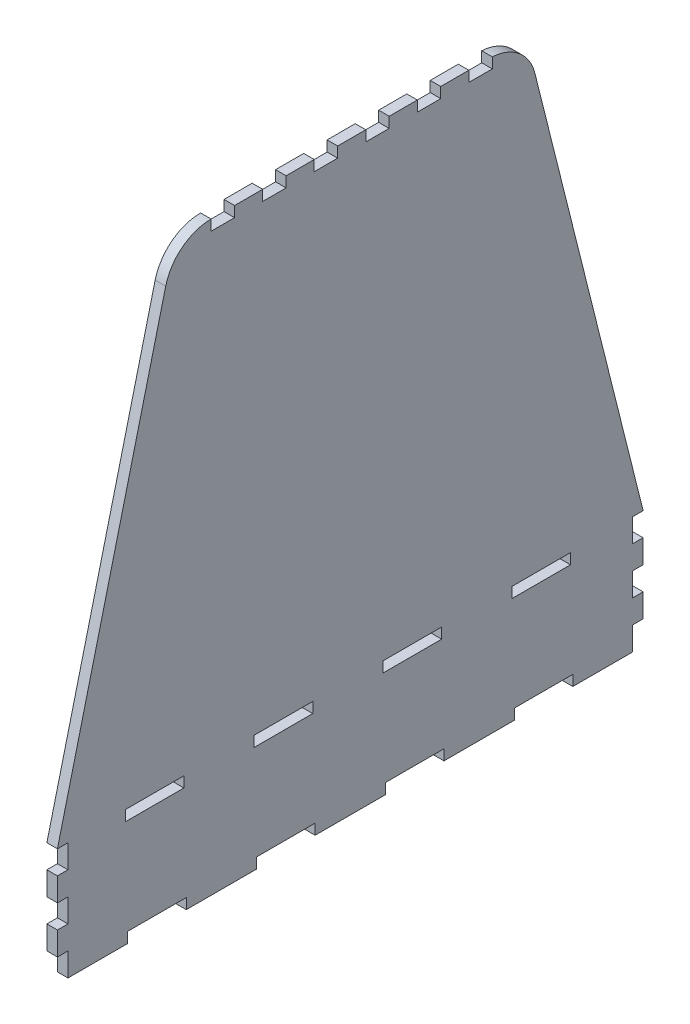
SolidWorks part; units mm, degrees
ref_plane "Front Plane" through (0, 0, 0) normal (0, 0, 1) x (1, 0, 0)
ref_plane "Top Plane" through (0, 0, 0) normal (0, 1, 0) x (1, 0, 0)
ref_plane "Right Plane" through (0, 0, 0) normal (1, 0, 0) x (0, 0, -1)
sketch "Sketch2" plane through (0, 0, 0) normal (1, 0, 0) x (0, 0, -1)
  line L1 (250, -256.4378) -> (157.5746, 113.2637)
  line L2 (118.7689, 143.5622) -> (-118.7689, 143.5622)
  line L3 (-157.5746, 113.2637) -> (-250, -256.4378)
  line L83 (250, -256.4378) -> (250, -356.4378)
  line L84 (250, -356.4378) -> (-250, -356.4378)
  line L85 (-250, -256.4378) -> (-250, -356.4378)
  arc A2 (-118.7689, 143.5622) -> (-157.5746, 113.2637) centre (-118.7689, 103.5622) ccw
  arc A3 (157.5746, 113.2637) -> (118.7689, 143.5622) centre (118.7689, 103.5622) ccw
  point P2 (0, 143.5622)
  point P5 (0, -356.4378)
  point P12 (-150, 143.5622)
  point P17 (150, 143.5622)
  dimension "D3" = 40
  dimension "D1" = 400
  dimension "D2" = 300
  dimension "D5" = 100
  dimension "D11" = 500
extrude "Boss-Extrude1" add sketch "Sketch2" along normal blind 9
sketch "Sketch5" plane through (0, 0, 0) normal (-1, 0, 0) x (0, 0, 1)
  line L0 (250, -356.4378) -> (-250, -356.4378) construction
  line L1 (-190, -356.4378) -> (-140, -356.4378)
  line L2 (-190, -356.4378) -> (-190, -347.4378)
  line L3 (-190, -347.4378) -> (-140, -347.4378)
  line L4 (-140, -356.4378) -> (-140, -347.4378)
  line L5 (-78, -256.4378) -> (-78, -265.4378)
  line L6 (-188, -256.4378) -> (-138, -256.4378)
  line L7 (-188, -256.4378) -> (-188, -265.4378)
  line L8 (-188, -265.4378) -> (-138, -265.4378)
  line L9 (-138, -256.4378) -> (-138, -265.4378)
  line L10 (-78, -256.4378) -> (-28, -256.4378)
  line L11 (-28, -256.4378) -> (-28, -265.4378)
  line L12 (-78, -265.4378) -> (-28, -265.4378)
  line L13 (-80, -356.4378) -> (-80, -347.4378)
  line L14 (-80, -356.4378) -> (-30, -356.4378)
  line L15 (-30, -356.4378) -> (-30, -347.4378)
  line L16 (-80, -347.4378) -> (-30, -347.4378)
  line L17 (32, -256.4378) -> (32, -265.4378)
  line L18 (32, -256.4378) -> (82, -256.4378)
  line L19 (82, -256.4378) -> (82, -265.4378)
  line L20 (32, -265.4378) -> (82, -265.4378)
  line L21 (30, -356.4378) -> (30, -347.4378)
  line L22 (30, -356.4378) -> (80, -356.4378)
  line L23 (80, -356.4378) -> (80, -347.4378)
  line L24 (30, -347.4378) -> (80, -347.4378)
  line L25 (142, -256.4378) -> (142, -265.4378)
  line L26 (142, -256.4378) -> (192, -256.4378)
  line L27 (192, -256.4378) -> (192, -265.4378)
  line L28 (142, -265.4378) -> (192, -265.4378)
  line L29 (140, -356.4378) -> (140, -347.4378)
  line L30 (140, -356.4378) -> (190, -356.4378)
  line L31 (190, -356.4378) -> (190, -347.4378)
  line L32 (140, -347.4378) -> (190, -347.4378)
  line L33 (74.7689, 143.5622) -> (74.7689, 134.5622)
  line L34 (118.7689, 143.5622) -> (98.7689, 143.5622)
  line L35 (118.7689, 143.5622) -> (118.7689, 134.5622)
  line L36 (118.7689, 134.5622) -> (98.7689, 134.5622)
  line L37 (98.7689, 143.5622) -> (98.7689, 134.5622)
  line L38 (74.7689, 143.5622) -> (54.7689, 143.5622)
  line L39 (54.7689, 143.5622) -> (54.7689, 134.5622)
  line L40 (74.7689, 134.5622) -> (54.7689, 134.5622)
  line L41 (30.7689, 143.5622) -> (30.7689, 134.5622)
  line L42 (30.7689, 143.5622) -> (10.7689, 143.5622)
  line L43 (10.7689, 143.5622) -> (10.7689, 134.5622)
  line L44 (30.7689, 134.5622) -> (10.7689, 134.5622)
  line L45 (-13.2311, 143.5622) -> (-13.2311, 134.5622)
  line L46 (-13.2311, 143.5622) -> (-33.2311, 143.5622)
  line L47 (-33.2311, 143.5622) -> (-33.2311, 134.5622)
  line L48 (-13.2311, 134.5622) -> (-33.2311, 134.5622)
  line L49 (-57.2311, 143.5622) -> (-57.2311, 134.5622)
  line L50 (-57.2311, 143.5622) -> (-77.2311, 143.5622)
  line L51 (-77.2311, 143.5622) -> (-77.2311, 134.5622)
  line L52 (-57.2311, 134.5622) -> (-77.2311, 134.5622)
  line L53 (-101.2311, 143.5622) -> (-101.2311, 134.5622)
  line L54 (-101.2311, 143.5622) -> (-121.2311, 143.5622)
  line L55 (-121.2311, 143.5622) -> (-121.2311, 134.5622)
  line L56 (-101.2311, 134.5622) -> (-121.2311, 134.5622)
  dimension "D1" = 50
  dimension "D2" = 9
  dimension "D3" = 60
  dimension "D4" = 50
  dimension "D5" = 62
  dimension "D7" = 9
  dimension "D9" = 20
  dimension "D10" = 9
  dimension "D11" = 60
  dimension "D6" = 4
extrude "Cut-Extrude2" cut sketch "Sketch5" against normal through all
sketch "Sketch4" plane through (9, 0, 0) normal (1, 0, 0) x (0, 0, -1)
  line L16 (-250, -296.4378) -> (-250, -316.4378)
  line L17 (-250, -256.4378) -> (-241, -256.4378)
  line L18 (-250, -256.4378) -> (-250, -276.4378)
  line L19 (-250, -276.4378) -> (-241, -276.4378)
  line L20 (-241, -256.4378) -> (-241, -276.4378)
  line L21 (-250, -296.4378) -> (-241, -296.4378)
  line L22 (-241, -296.4378) -> (-241, -316.4378)
  line L23 (-250, -316.4378) -> (-241, -316.4378)
  line L24 (-250, -336.4378) -> (-250, -356.4378)
  line L25 (-250, -336.4378) -> (-241, -336.4378)
  line L26 (-241, -336.4378) -> (-241, -356.4378)
  line L27 (-250, -356.4378) -> (-241, -356.4378)
  line L28 (0, 0) -> (0, -410.2917) construction
  line L29 (250, -276.4378) -> (241, -276.4378)
  line L30 (241, -256.4378) -> (241, -276.4378)
  line L31 (250, -256.4378) -> (241, -256.4378)
  line L32 (250, -256.4378) -> (250, -276.4378)
  line L33 (250, -336.4378) -> (241, -336.4378)
  line L34 (241, -336.4378) -> (241, -356.4378)
  line L35 (250, -356.4378) -> (241, -356.4378)
  line L36 (250, -336.4378) -> (250, -356.4378)
  line L37 (250, -296.4378) -> (241, -296.4378)
  line L38 (241, -296.4378) -> (241, -316.4378)
  line L39 (250, -316.4378) -> (241, -316.4378)
  line L40 (250, -296.4378) -> (250, -316.4378)
  dimension "D1" = 20
  dimension "D2" = 9
  dimension "D3" = 3
extrude "Cut-Extrude3" cut sketch "Sketch4" against normal through all
